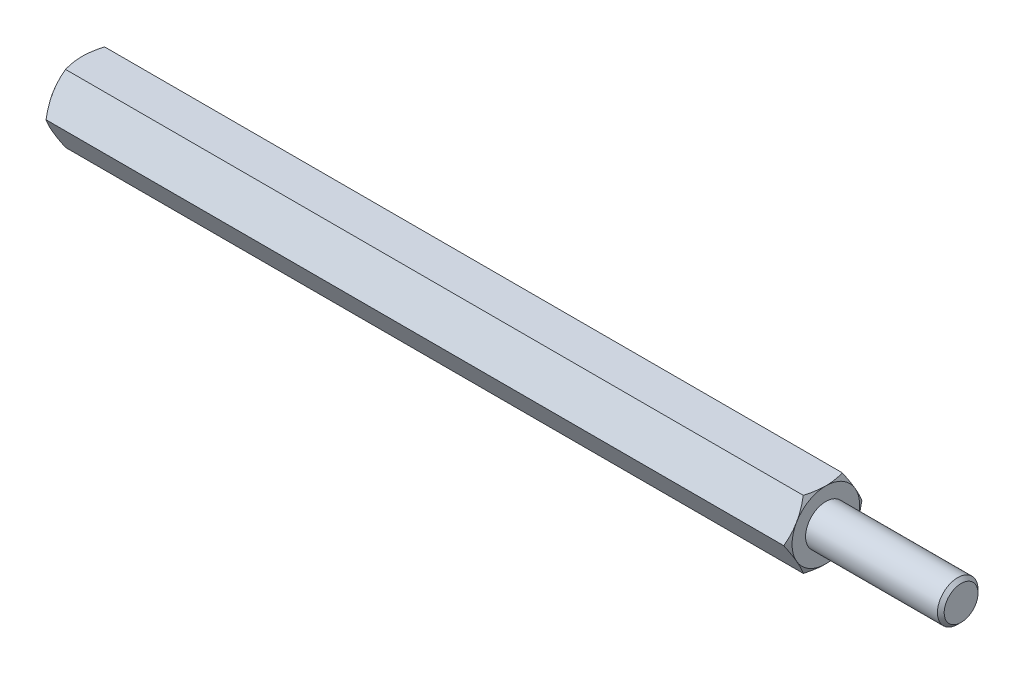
SolidWorks part; units mm, degrees
ref_plane "Front Plane" through (0, 0, 0) normal (0, 0, 1) x (1, 0, 0)
ref_plane "Top Plane" through (0, 0, 0) normal (0, 1, 0) x (1, 0, 0)
ref_plane "Right Plane" through (0, 0, 0) normal (1, 0, 0) x (0, 0, -1)
sketch "Sketch1" plane through (0, 0, 0) normal (1, 0, 0) x (0, 0, -1)
  line L1 (1.4434, 2.5) -> (-1.4434, 2.5)
  line L2 (-1.4434, 2.5) -> (-2.8868, 0)
  line L3 (-2.8868, 0) -> (-1.4434, -2.5)
  line L4 (-1.4434, -2.5) -> (1.4434, -2.5)
  line L5 (1.4434, -2.5) -> (2.8868, 0)
  line L6 (2.8868, 0) -> (1.4434, 2.5)
  circle A0 centre (0, 0) radius 2.5 construction
  dimension "D1" = 5
extrude "Extrude2" add sketch "Sketch1" along normal mid plane 55
sketch "Sketch2" plane through (0, 0, 0) normal (0, 0, 1) x (1, 0, 0)
  line L0 (-27.5, 2.5) -> (-26, 5.0981)
  line L1 (-27.5, 5.5) -> (-27.5, 2.5)
  line L3 (0, 0) -> (50000, 0) construction
  arc A0 (-26, 5.0981) -> (-27.5, 5.5) centre (-26.6962, 5.5) ccw
  dimension "D1" = 30
  dimension "D2" = 3
revolve "Cut-Revolve1" cut sketch "Sketch2" angle 360 about L3
mirror "Mirror1" about plane through (0, 0, 0) normal (1, 0, 0) of "Cut-Revolve1"
sketch "Sketch3" plane through (-27.5, 0, 0) normal (-1, 0, 0) x (0, 0, 1)
  circle A0 centre (0, 0) radius 1.25
  dimension "D1" = 2.5
extrude "Extrude3" cut sketch "Sketch3" against normal blind 10
sketch "Sketch4" plane through (0, 0, 0) normal (0, 0, 1) x (1, 0, 0)
  line L0 (-17.5, 0) -> (-17.5, 1.25)
  line L1 (27.2767, 0) -> (-27.2767, 0) construction
  line L2 (-17.5, 1.25) -> (-16.7783, 0)
  line L3 (-16.7783, 0) -> (-17.5, 0)
  line L4 (-27.5, 1.25) -> (-27.5, -1.25) construction
  point P4 (-27.5, 0)
  dimension "D1" = 30
  dimension "D2" = 1.25
  dimension "D3" = 10
revolve "Cut-Revolve2" cut sketch "Sketch4" angle 360 about L3
sketch "Sketch5" plane through (27.5, 0, 0) normal (1, 0, 0) x (0, 0, -1)
  circle A0 centre (0, 0) radius 1.5
  dimension "D1" = 3
extrude "Extrude4" add sketch "Sketch5" along normal blind 10
chamfer "Chamfer1" distance 0.25 angle 45 1 edges at (37.5, 0, -1.5)
equation "\"D2@Sketch4\" = \"D1@Sketch3\"/2"
